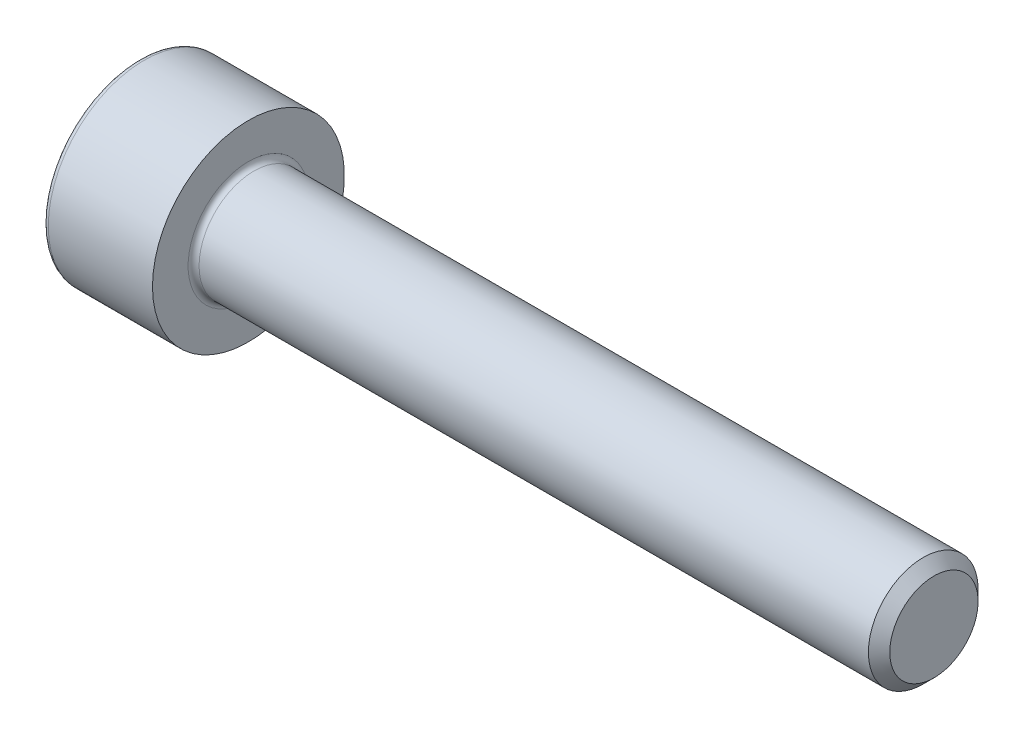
SolidWorks part; units mm, degrees
revolve "Base-Revolve" add sketch "BodySke"
sketch "BodySke" plane through (0, 0, 0) normal (0, 0, 1) x (1, 0, 0)
  line L0 (0, 0) -> (0, 3.5)
  line L1 (0, 3.5) -> (4, 3.5)
  line L2 (4, 3.5) -> (4, 2)
  line L3 (4, 2) -> (28.61, 2)
  line L4 (29, 1.61) -> (29, 0)
  line L5 (29, 0) -> (0, 0)
  line L6 (-31.75, 0) -> (127, 0) construction
  line L8 (29, 1.61) -> (28.61, 2)
  line L10 (29, -1.61) -> (28.61, -2) construction
  line L11 (4.7, 9.525) -> (4.7, 3.175) construction
  line L12 (4, 9.525) -> (4, 3.175) construction
  line L13 (-31, 9.525) -> (-31, 3.175) construction
fillet "Fillet1" radius 0.2 1 edges at (4, 0, 2)
fillet "Fillet2" radius 0.2 1 edges at (0, 0, 3.5)
ref_plane "Plane1" through (0, 0, 0) normal (0, 0, 1) x (1, 0, 0)
ref_plane "Plane2" through (0, 0, 0) normal (0, 1, 0) x (1, 0, 0)
ref_plane "Plane3" through (0, 0, 0) normal (1, 0, 0) x (0, 0, -1)
other "Configuration Table"
sketch "Sketch2" plane through (0, 0, 0) normal (0, 0, 1) x (1, 0, 0)
  line L0 (0, 1.5355) -> (2, 1.5355)
  line L1 (2, 1.5355) -> (2.8865, 0)
  line L2 (-31.75, 0) -> (127, 0) construction
  line L3 (2.8865, 0) -> (0, 0)
  line L4 (0, 0) -> (0, 1.5355)
  line L6 (0, 0) -> (47.625, 0) construction
revolve "Hex-PreBroach" cut sketch "Sketch2" angle 360 about L6
sketch "Sketch3" plane through (0, 0, 0) normal (-1, 0, 0) x (0, 0.5, 0.866)
  line L0 (0.8865, 1.5355) -> (-0.8865, 1.5355)
  line L1 (-0.8865, 1.5355) -> (-1.773, 0)
  line L2 (0.8865, 1.5355) -> (1.773, 0)
  line L3 (0.8865, -1.5355) -> (1.773, 0)
  line L4 (0.8865, -1.5355) -> (-0.8865, -1.5355)
  line L5 (-0.8865, -1.5355) -> (-1.773, 0)
extrude "Hex" cut sketch "Sketch3" against normal blind 2
sketch "ThdSchSke" plane through (0, 0, 0) normal (0, 0, 1) x (1, 0, 0)
  line L0 (6.1, -1.61) -> (5.8269, -2)
  line L1 (6.1, -1.61) -> (6.3731, -2)
  line L2 (6.3731, -2) -> (6.3731, -2.5)
  line L3 (-3.175, 0) -> (5.1513, 0) construction
  line L4 (0, 3.3) -> (0, -3.3) construction
  line L5 (6.3731, -2.5) -> (5.8269, -2.5)
  line L6 (5.8269, -2.5) -> (5.8269, -2)
revolve "ThreadSchematic" [suppressed] cut sketch "ThdSchSke" angle 360 about L3
pattern_linear "ThdSchPat" [suppressed]
equation "\"D2@Sketch3\" = \"Hex_size@Sketch3\" / 2"
equation "\"D1@Sketch3\" = \"Hex_size@Sketch3\" / 2"
equation "\"D1@Sketch2\" = \"Hex_size@Sketch3\" / 2"
equation "\"Thread_minor@ThreadCosmetic\"  =  \"Minor_dia@BodySke\""
equation "\"Depth@Sketch2\" =  \"Key_eng@Hex\""
equation "\"Thread_length@ThreadCosmetic\" = ((sgn( (\"Length@BodySke\" - \"Advance@BodySke\" * 3.0) - \"Thread_nom@BodySke\" )-1)*( (\"Length@BodySke\" - \"Advance@BodySke\" * 3.0) - \"Thread_nom@BodySke\" ))/-2+ \"Thread_no"
equation "\"Thread_minor@ThdSchSke\" = \"Minor_dia@BodySke\""
equation "\"Diameter@ThdSchSke\" = \"Diameter@BodySke\""
equation "\"Overcut@ThdSchSke\" = \"Diameter@BodySke\" * 1.25"
equation "\"Start@ThdSchSke\" = \"Head_ht@BodySke\" + \"Length@BodySke\" - \"Thread_length@ThreadCosmetic\"  '---Non-countersunk---"
equation "\"Num_threads@ThdSchPat\" = int( \"Thread_length@ThreadCosmetic\" / \"Advance@BodySke\" + 0.999 )  + 1"
equation "\"Advance@ThdSchPat\" = \"Thread_length@ThreadCosmetic\" /  (\"Num_threads@ThdSchPat\" - 1) 'relax it"
equation "\"Num_threads@ThdSchPat\" = \"Num_threads@ThdSchPat\" - sgn( \"Num_threads@ThdSchPat\" - 1) '---chamfered tips only---"
